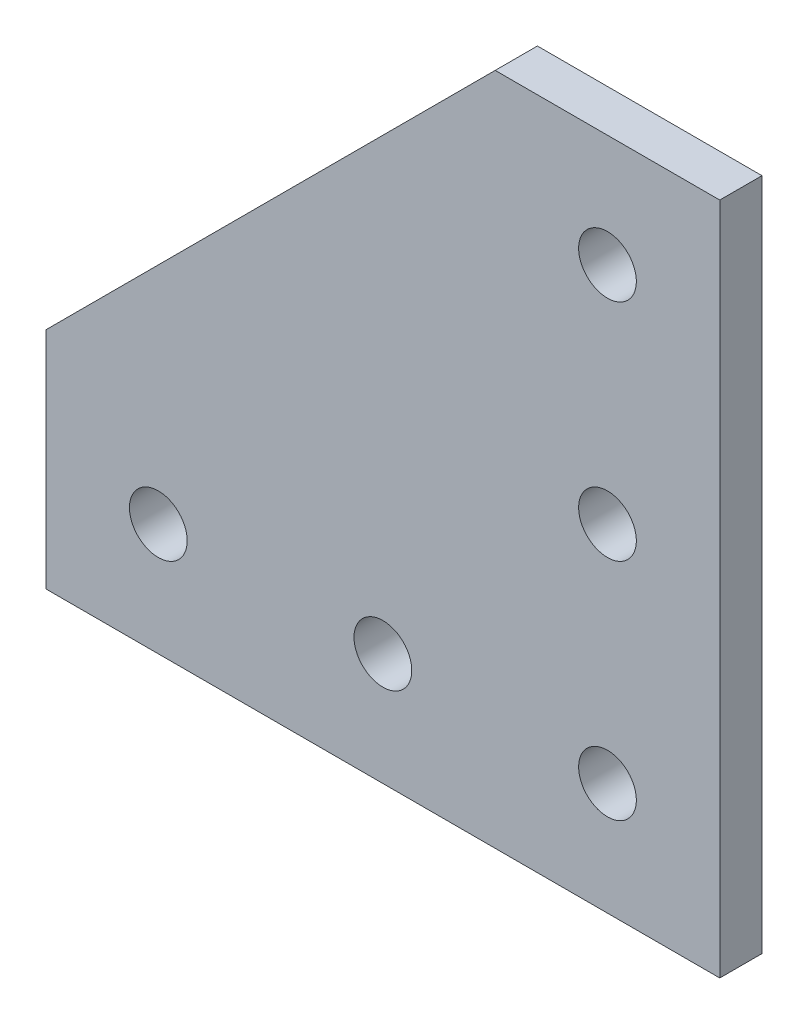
SolidWorks part; units mm, degrees
ref_plane "Front Plane" through (0, 0, 0) normal (0, 0, 1) x (1, 0, 0)
ref_plane "Top Plane" through (0, 0, 0) normal (0, 1, 0) x (1, 0, 0)
ref_plane "Right Plane" through (0, 0, 0) normal (1, 0, 0) x (0, 0, -1)
ref_plane "Plane1" through (0, 0, 4.7752) normal (0, 0, 1) x (1, 0, 0)
sketch "Sketch1" plane through (0, 0, 4.7752) normal (0, 0, 1) x (1, 0, 0)
  line L0 (12.7, 76.2) -> (-38.1, 25.4)
  line L1 (-38.1, 25.4) -> (-38.1, 0)
  line L2 (-38.1, 0) -> (38.1, 0)
  line L3 (38.1, 0) -> (38.1, 76.2)
  line L4 (38.1, 76.2) -> (12.7, 76.2)
  circle A0 centre (-25.4, 12.7) radius 3.2639
  circle A1 centre (0, 12.7) radius 3.2639
  circle A2 centre (25.4, 63.5) radius 3.2639
  circle A3 centre (25.4, 38.1) radius 3.2639
  circle A4 centre (25.4, 12.7) radius 3.2639
extrude "Boss-Extrude1" add sketch "Sketch1" against normal blind 4.7752
